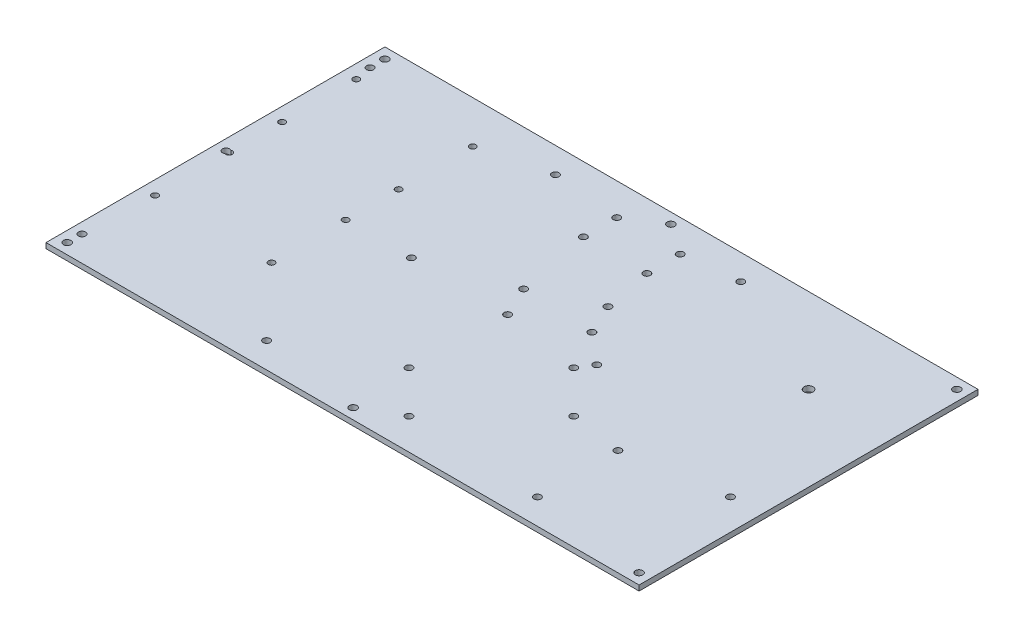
SolidWorks part; units mm, degrees
ref_plane "Front Plane" through (0, 0, 0) normal (0, 0, 1) x (1, 0, 0)
ref_plane "Top Plane" through (0, 0, 0) normal (0, 1, 0) x (1, 0, 0)
ref_plane "Right Plane" through (0, 0, 0) normal (1, 0, 0) x (0, 0, -1)
sketch "Sketch1" plane through (0, 0, 0) normal (0, 1, 0) x (1, 0, 0)
  line L1 (0, 0) -> (355.6, 0)
  line L2 (0, 0) -> (0, 203.2)
  line L3 (0, 203.2) -> (355.6, 203.2)
  line L4 (355.6, 0) -> (355.6, 203.2)
  dimension "D1" = 203.2
  dimension "D2" = 355.6
extrude "Boss-Extrude1" add sketch "Sketch1" along normal blind 3.175
hole_wizard "#8 Clearance Hole1" positions "Sketch2" profile "Sketch3" hole size "#8" standard "ANSI Inch"
sketch "Sketch2" plane through (0, 3.175, 0) normal (0, 1, 0) x (1, 0, 0)
  line L0 (6.35, 196.85) -> (349.25, 196.85) construction
  line L1 (349.25, 196.85) -> (349.25, 6.35) construction
  line L2 (349.25, 6.35) -> (6.35, 6.35) construction
  line L3 (6.35, 6.35) -> (6.35, 196.85) construction
  line L5 (0, 203.2) -> (0, 0) construction
  line L6 (355.6, 203.2) -> (0, 203.2) construction
  line L7 (355.6, 0) -> (355.6, 203.2) construction
  line L8 (0, 0) -> (355.6, 0) construction
  point P0 (6.35, 196.85)
  point P2 (177.8, 196.85)
  point P4 (349.25, 196.85)
  point P6 (349.25, 6.35)
  point P8 (177.8, 6.35)
  point P10 (6.35, 6.35)
  dimension "D1" = 6.35
  dimension "D3" = 6.35
  dimension "D5" = 6.35
  dimension "D6" = 6.35
sketch "Sketch3" plane through (6.35, 3.175, -196.85) normal (1, 0, 0) x (0, 0, 1)
  line L0 (0, 0) -> (0, 3.175)
  line L1 (0, 3.175) -> (2.2479, 3.175)
  line L2 (2.2479, 3.175) -> (2.2479, 0)
  line L5 (2.2479, 0) -> (0, 0)
  line L11 (0, -6.35) -> (0, 107.95) construction
  dimension "Thru Hole Dia." = 4.4958
  dimension "Thru Hole Depth" = 3.175
hole_wizard "#6 Clearance Hole1" positions "Sketch4" profile "Sketch5" hole size "#6" standard "ANSI Inch"
sketch "Sketch4" plane through (0, 0, 0) normal (0, -1, 0) x (-1, 0, 0)
  point P0 (-8.2048, 57.1683)
  point P3 (-8.2048, 101.6183)
  point P6 (-78.0548, 101.6183)
  point P9 (-78.0548, 57.1683)
  point P12 (-8.2048, 133.3683)
  point P15 (-78.0548, 133.3683)
  point P18 (-78.0548, 177.8183)
  point P21 (-8.2048, 177.8183)
sketch "Sketch5" plane through (8.2048, 0, -57.1683) normal (1, 0, 0) x (0, 0, -1)
  line L0 (0, 0) -> (0, 3.175)
  line L1 (0, 3.175) -> (1.8986, 3.175)
  line L2 (1.8986, 3.175) -> (1.8986, 0)
  line L5 (1.8986, 0) -> (0, 0)
  line L11 (0, -6.35) -> (0, 107.95) construction
  dimension "Thru Hole Dia." = 3.7973
  dimension "Thru Hole Depth" = 3.175
hole_wizard "Hole for #2 300® SC Nuts (SP)1" positions "Sketch6" profile "Sketch7" hole size "#2-56" standard "PEM® Inch"
sketch "Sketch6" plane through (0, 3.175, 0) normal (0, 1, 0) x (1, 0, 0)
  point P0 (173.8246, 43.797)
  point P3 (223.216, 93.1885)
  point P6 (248.3607, 68.0437)
  point P9 (198.9693, 18.6523)
  point P13 (337.2691, 73.1366)
sketch "Sketch7" plane through (173.8246, 3.175, -43.797) normal (1, 0, 0) x (0, 0, 1)
  line L0 (0, 0) -> (0, 3.175)
  line L1 (0, 3.175) -> (2.1082, 3.175)
  line L2 (2.1082, 3.175) -> (2.1082, 0)
  line L5 (2.1082, 0) -> (0, 0)
  line L11 (0, -6.35) -> (0, 107.95) construction
  dimension "Thru Hole Dia." = 4.2164
  dimension "Thru Hole Depth" = 3.175
hole_wizard "Hole for #4 300® SC Nuts (SP)1" positions "Sketch8" profile "Sketch9" hole size "#4-40" standard "PEM® Inch"
sketch "Sketch8" plane through (0, 3.175, 0) normal (0, 1, 0) x (1, 0, 0)
  line L0 (6.35, 187.96) -> (228.6, 187.96) construction
  line L1 (228.6, 187.96) -> (228.6, 101.6) construction
  line L3 (6.35, 101.6) -> (228.6, 101.6) construction
  line L5 (6.35, 187.96) -> (6.35, 15.24) construction
  line L6 (6.35, 15.24) -> (279.4, 15.24) construction
  line L7 (279.4, 15.24) -> (279.4, 63.5) construction
  line L9 (355.6, 203.2) -> (0, 203.2) construction
  line L10 (0, 203.2) -> (0, 0) construction
  line L12 (0, 0) -> (355.6, 0) construction
  line L13 (117.475, 101.6) -> (117.0187, 15.24) construction
  point P0 (158.1449, 164.0628)
  point P3 (158.1177, 184.0628)
  point P6 (196.1177, 184.1144)
  point P9 (196.1449, 164.1144)
  point P12 (167.3023, 119.1088)
  point P15 (175.7792, 100.9941)
  point P18 (210.1971, 117.1003)
  point P21 (201.7201, 135.215)
  point P26 (6.35, 187.96)
  point P28 (6.35, 101.6)
  point P30 (6.35, 15.24)
  point P32 (117.0187, 15.24)
  point P34 (117.475, 101.6)
  point P36 (117.475, 187.96)
  point P38 (228.6, 187.96)
  point P40 (228.6, 101.6)
  point P42 (279.4, 63.5)
  point P44 (279.4, 15.24)
  dimension "D1" = 15.24
  dimension "D2" = 6.35
  dimension "D3" = 15.24
  dimension "D4" = 228.6
  dimension "D5" = 279.4
  dimension "D6" = 101.6
  dimension "D7" = 63.5
sketch "Sketch9" plane through (158.1449, 3.175, -164.0628) normal (1, 0, 0) x (0, 0, 1)
  line L0 (0, 0) -> (0, 3.175)
  line L1 (0, 3.175) -> (2.1082, 3.175)
  line L2 (2.1082, 3.175) -> (2.1082, 0)
  line L5 (2.1082, 0) -> (0, 0)
  line L11 (0, -6.35) -> (0, 107.95) construction
  dimension "Thru Hole Dia." = 4.2164
  dimension "Thru Hole Depth" = 3.175
hole_wizard "Hole for #8 300® SC Nuts (SP)1" positions "Sketch10" profile "Sketch11" hole size "#8-32" standard "PEM® Inch"
sketch "Sketch10" plane through (0, 3.175, 0) normal (0, 1, 0) x (1, 0, 0)
  line L2 (0, 203.2) -> (0, 0) construction
  line L3 (0, 0) -> (355.6, 0) construction
  point P0 (304.8, 152.4)
  dimension "D1" = 304.8
  dimension "D2" = 152.4
sketch "Sketch11" plane through (304.8, 3.175, -152.4) normal (1, 0, 0) x (0, 0, 1)
  line L0 (0, 0) -> (0, 3.175)
  line L1 (0, 3.175) -> (2.7051, 3.175)
  line L2 (2.7051, 3.175) -> (2.7051, 0)
  line L5 (2.7051, 0) -> (0, 0)
  line L11 (0, -6.35) -> (0, 107.95) construction
  dimension "Thru Hole Dia." = 5.4102
  dimension "Thru Hole Depth" = 3.175
